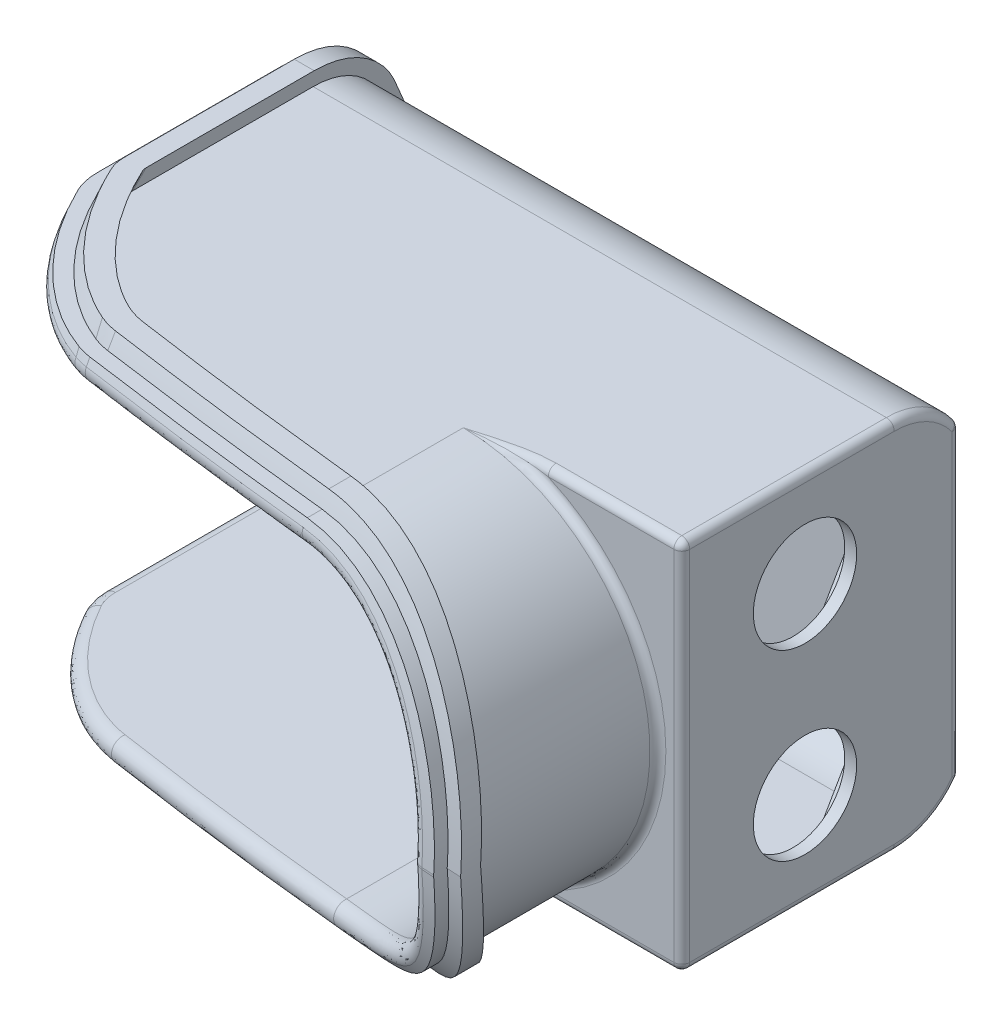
SolidWorks part; units mm, degrees
ref_plane "Face" through (0, 0, 0) normal (0, 0, 1) x (1, 0, 0)
ref_plane "Dessus" through (0, 0, 0) normal (0, 1, 0) x (1, 0, 0)
ref_plane "Droite" through (0, 0, 0) normal (1, 0, 0) x (0, 0, -1)
surface "Surface-Décalage1" parameters "D1"=0.5
fillet "Congé 10mm (1)" radius 10
surface "Surface-Décalage4" parameters "D1"=0
surface "Surface-Décalage5" parameters "D1"=1.8
surface "Surface-Décalage2" parameters "D1"=0
surface "Surface-Décalage3" parameters "D1"=0
surface "Surface-Décalage6" parameters "D1"=1.7
surface "Surface-Décalage7" parameters "D1"=1.7
surface "Surface-Décalage8" parameters "D1"=2.5
surface "Surface-Décalage9" parameters "D1"=2.5
surface "Surface-Ajustée1"
thicken "Base-Epaissir" surfaces to thicken 104
surface "Surface-Ajustée2"
surface "Surface-Ajustée3"
surface "Surface-Décalage10" parameters "D1"=0
ref_plane "Plan1" through (0, 36.0035, 0) normal (0, 1, 0) x (-1, 0, 0)
sketch "Esquisse1" plane through (0, 0, 0) normal (0, 0, 1) x (1, 0, 0)
  line L0 (-121.8946, 36.0035) -> (-29.3558, 36.0035)
  line L3 (50, 36.0035) -> (-50, 36.0035) construction
surface "Surface-Extrusion1" sketch "Esquisse1" parameters "D1"=180
surface "Surface-Décalage11" parameters "D1"=0
surface "Surface-Ajustée4"
surface "Surface-Ajustée5"
surface "Surface-Ajustée6"
surface "Surface-Ajustée7"
ref_plane "Plan2" through (-75, 0, 0) normal (1, 0, 0) x (0, 0, -1)
sketch "Esquisse2" plane through (-75, 0, 0) normal (1, 0, 0) x (0, 0, -1)
  line L0 (-103.7702, 59.5) -> (-103.7702, 12.5) construction
  line L3 (-103.7702, 12.5) -> (-126.1871, 12.5) construction
  line L4 (-103.7702, 59.5) -> (-126.703, 59.5) construction
  line L5 (-103.7702, 12.5) -> (-130.5, 12.5)
  line L6 (-103.7702, 59.5) -> (-130.5, 59.5)
  line L7 (-130.5, 59.5) -> (-130.5, 12.5)
  arc A0 (-103.7702, 12.5) -> (-94.8788, 17.9237) centre (-103.7702, 22.5) ccw construction
  arc A1 (-94.8788, 17.9237) -> (-94.8788, 54.0763) centre (-130, 36) ccw construction
  arc A2 (-94.8788, 54.0763) -> (-103.7702, 59.5) centre (-103.7702, 49.5) ccw construction
  arc A3 (-103.7702, 12.5) -> (-94.8788, 17.9237) centre (-103.7702, 22.5) ccw
  arc A4 (-94.8788, 17.9237) -> (-94.8788, 54.0763) centre (-130, 36) ccw
  arc A5 (-94.8788, 54.0763) -> (-103.7702, 59.5) centre (-103.7702, 49.5) ccw
  dimension "D1" = 40
extrude "Boss.-Extru.1" add sketch "Esquisse2" along normal blind 36.5
sketch "Esquisse3" plane through (-38.5, 0, 0) normal (1, 0, 0) x (0, 0, -1)
  line L0 (-95.5, 64.3714) -> (-95.5, 7.1783)
  line L1 (-130.5, 59.5) -> (-130.5, 12.5) construction
  line L2 (-95.5, 64.3714) -> (-79.3443, 64.3714)
  line L3 (-79.3443, 64.3714) -> (-79.3443, 7.1783)
  line L4 (-79.3443, 7.1783) -> (-95.5, 7.1783)
  dimension "D1" = 35
extrude "Enlèv. mat.-Extru.1" cut sketch "Esquisse3" against normal blind 70
shell "Coque 3mm" thickness 3
ref_plane "Plan3" through (0, 36, 0) normal (0, -1, 0) x (1, 0, 0)
thicken "Bossage-épaissir1" surfaces to thicken 128
thicken "Bossage-épaissir2" surfaces to thicken 129
fillet "Congé 10mm (2)" radius 10
sketch "Esquisse4" plane through (-41.5, 0, 0) normal (-1, 0, 0) x (0, 0, 1)
  line L1 (93.5, 36) -> (127.5, 36) construction
  line L2 (127.5, 56.5) -> (127.5, 15.5) construction
  arc A0 (97.5462, 52.7034) -> (97.5462, 19.2966) centre (130, 36) ccw construction
  circle A1 centre (115, 47.5) radius 6.5
  circle A2 centre (115, 24.5) radius 6.5
  dimension "D1" = 13
  dimension "D2" = 11.5
  dimension "D3" = 12.5
extrude "Enlèv. mat.-Extru.2" cut sketch "Esquisse4" against normal up to next
fillet "Congé1" radius 1.5
fillet "Congé2" radius 1.5
fillet "Congé3" radius 1
fillet "Congé4" radius 1
fillet "Congé7" radius 1
fillet "Congé8" radius 1
fillet "Congé9" radius 1
fillet "Congé10" radius 1
fillet "Congé11" radius 1
fillet "Congé13" radius 1
fillet "Congé14" radius 1
sketch "Esquisse5" plane through (0, 12.5, 0) normal (0, -1, 0) x (1, 0, 0)
  line L0 (-41.5, 98.5) -> (-111.5896, 98.5) construction
  line L1 (-41.5, 127.5) -> (-41.5, 103.7702) construction
  circle A0 centre (-84.5, 105) radius 4.5
  dimension "D1" = 6.5
  dimension "D3" = 9
  dimension "D2" = 43
extrude "Enlèv. mat.-Extru.3" cut sketch "Esquisse5" against normal blind 5
sketch "Esquisse6" plane through (-41.5, 0, 0) normal (-1, 0, 0) x (0, 0, 1)
  line L0 (119.6227, 55.4977) -> (110.3851, 55.5023)
  line L1 (119.6227, 32.4977) -> (110.3851, 32.5023)
  line L2 (110.3851, 32.5023) -> (105.7624, 24.5045)
  line L3 (105.7624, 24.5045) -> (110.3773, 16.5023)
  line L4 (110.3773, 16.5023) -> (119.6149, 16.4977)
  line L5 (119.6149, 16.4977) -> (124.2376, 24.4955)
  line L6 (124.2376, 24.4955) -> (119.6227, 32.4977)
  line L7 (110.3851, 55.5023) -> (105.7624, 47.5045)
  line L8 (105.7624, 47.5045) -> (110.3773, 39.5023)
  line L9 (110.3773, 39.5023) -> (119.6149, 39.4977)
  line L10 (119.6149, 39.4977) -> (124.2376, 47.4955)
  line L11 (124.2376, 47.4955) -> (119.6227, 55.4977)
  circle A0 centre (115, 24.5) radius 8 construction
  circle A1 centre (115, 47.5) radius 8 construction
  dimension "D1" = 16
extrude "Enlèv. mat.-Extru.4" cut sketch "Esquisse6" against normal blind 1.5
